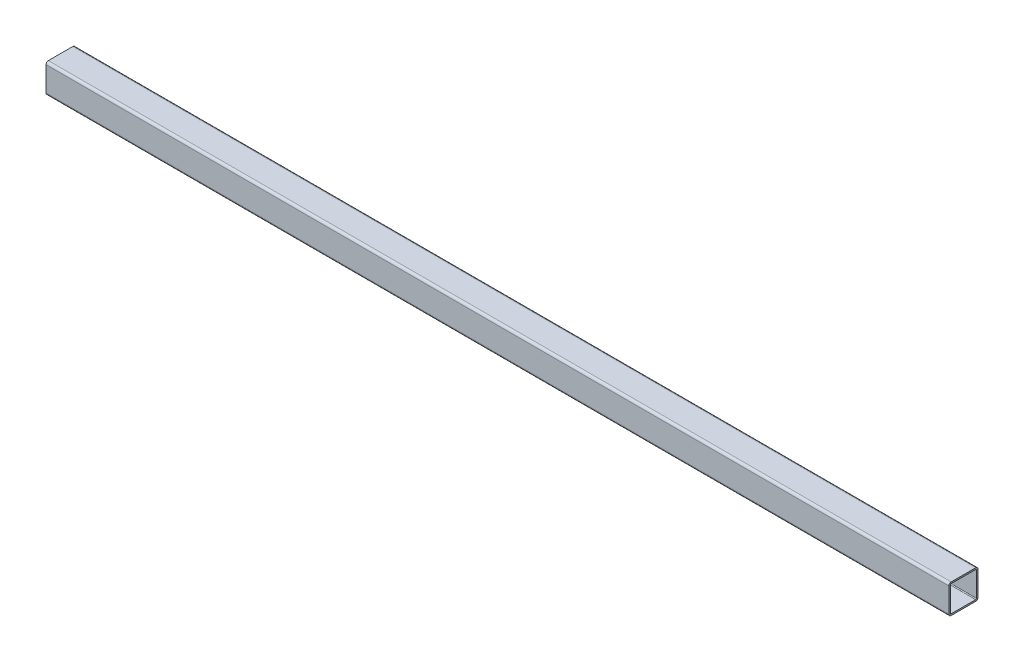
SolidWorks part; units mm, degrees
ref_plane "Front Plane" through (0, 0, 0) normal (0, 0, 1) x (1, 0, 0)
ref_plane "Top Plane" through (0, 0, 0) normal (0, 1, 0) x (1, 0, 0)
ref_plane "Right Plane" through (0, 0, 0) normal (1, 0, 0) x (0, 0, -1)
sketch "Sketch1" plane through (0, 0, 0) normal (1, 0, 0) x (0, 0, -1)
  line L0 (0, 2.54) -> (0, 29.21)
  line L1 (-2.54, 31.75) -> (-29.21, 31.75)
  line L2 (-31.75, 29.21) -> (-31.75, 2.54)
  line L3 (-29.21, 0) -> (-2.54, 0)
  line L4 (-1.651, 2.54) -> (-1.651, 29.21)
  line L5 (-2.54, 30.099) -> (-29.21, 30.099)
  line L6 (-30.099, 29.21) -> (-30.099, 2.54)
  line L7 (-29.21, 1.651) -> (-2.54, 1.651)
  arc A0 (-31.75, 2.54) -> (-29.21, 0) centre (-29.21, 2.54) ccw
  arc A1 (0, 2.54) -> (-2.54, 0) centre (-2.54, 2.54) cw
  arc A2 (0, 29.21) -> (-2.54, 31.75) centre (-2.54, 29.21) ccw
  arc A3 (-31.75, 29.21) -> (-29.21, 31.75) centre (-29.21, 29.21) cw
  arc A4 (-1.651, 29.21) -> (-2.54, 30.099) centre (-2.54, 29.21) ccw
  arc A5 (-30.099, 29.21) -> (-29.21, 30.099) centre (-29.21, 29.21) cw
  arc A6 (-30.099, 2.54) -> (-29.21, 1.651) centre (-29.21, 2.54) ccw
  arc A7 (-1.651, 2.54) -> (-2.54, 1.651) centre (-2.54, 2.54) cw
  point P12 (0, 0)
  point P15 (0, 31.75)
  point P18 (-31.75, 31.75)
  dimension "D3" = 2.54
  dimension "D1" = 31.75
  dimension "D2" = 31.75
  dimension "D4" = 1.651
extrude "Boss-Extrude1" add sketch "Sketch1" along normal blind 393.7
scale "Scale1" scale about centroid uniform scaling no x scale factor 1 y scale factor 0.4 z scale factor 0.4
